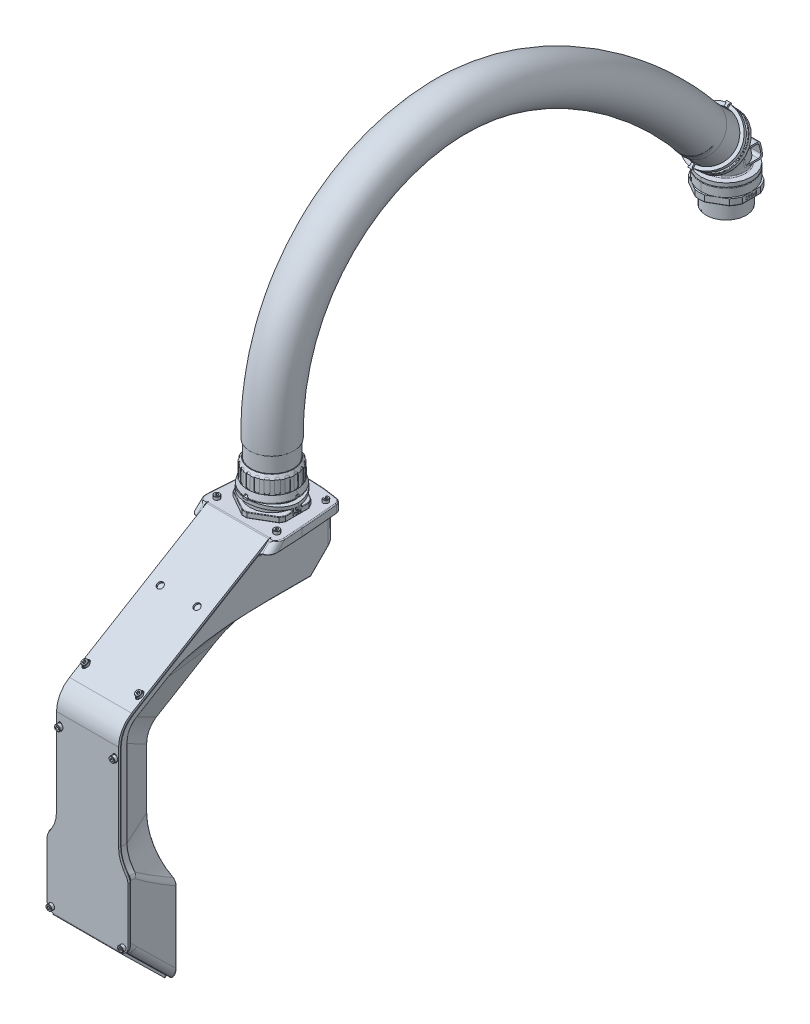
SolidWorks part; units mm, degrees
ref_plane "前视基准面" through (0, 0, 0) normal (0, 0, 1) x (1, 0, 0)
ref_plane "上视基准面" through (0, 0, 0) normal (0, 1, 0) x (1, 0, 0)
ref_plane "右视基准面" through (0, 0, 0) normal (1, 0, 0) x (0, 0, -1)
imported_body "MB10SC-800 外发模型-J5-1-solid1"
imported_body "MB10SC-800 外发模型-J5-1-solid2"
imported_body "接头-1-solid1"
imported_body "接头2-1-solid1"
combine bodies "组合2" operation type add bodies to combine 111 110 112 109
